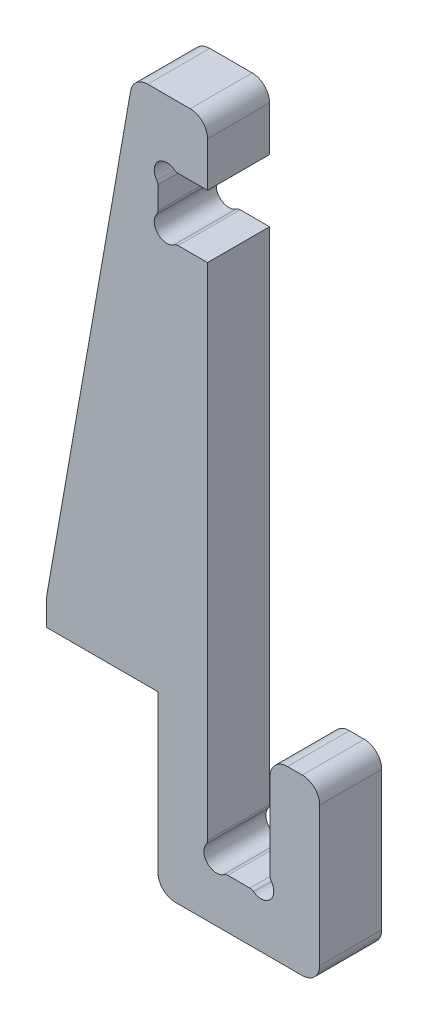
SolidWorks part; units mm, degrees
ref_plane "Plan de face" through (0, 0, 0) normal (0, 0, 1) x (1, 0, 0)
ref_plane "Plan de dessus" through (0, 0, 0) normal (0, 1, 0) x (1, 0, 0)
ref_plane "Plan de droite" through (0, 0, 0) normal (1, 0, 0) x (0, 0, -1)
sketch "Esquisse2" plane through (0, 0, 0) normal (0, 0, 1) x (1, 0, 0)
  line L0 (32.6, 32.6) -> (32.6, 20) construction
  line L2 (45.2, 70) -> (45.2, 28.131)
  line L3 (12.6, 242.4) -> (0, 242.4) construction
  line L4 (20, 229.8) -> (8.131, 229.8)
  line L5 (20, 229.8) -> (20, 28.131)
  line L6 (28.131, 20) -> (37.069, 20)
  line L7 (20, 20) -> (32.6, 32.6) construction
  line L8 (45.2, 70) -> (65.2, 70)
  line L9 (65.2, 70) -> (65.2, 0)
  line L10 (20, 255) -> (8.131, 255)
  line L11 (0, 246.869) -> (0, 237.931)
  line L12 (0, 255) -> (12.6, 242.4) construction
  line L13 (65.2, 0) -> (0, 0)
  line L14 (0, 0) -> (0, 70)
  line L15 (0, 70) -> (-45, 70)
  line L16 (-45, 70) -> (-45, 80)
  line L17 (-45, 80) -> (-10, 280)
  line L18 (-10, 280) -> (20, 280)
  line L19 (20, 280) -> (20, 255)
  arc A0 (19.5086, 26.6426) -> (26.6426, 19.5086) centre (23.6062, 23.6062) ccw
  arc A1 (19.5086, 26.6426) -> (20, 28.131) centre (17.5, 28.131) ccw
  arc A2 (26.6426, 19.5086) -> (28.131, 20) centre (28.131, 17.5) cw
  arc A3 (38.5574, 19.5086) -> (37.069, 20) centre (37.069, 17.5) ccw
  arc A4 (45.6914, 26.6426) -> (38.5574, 19.5086) centre (41.5938, 23.6062) cw
  arc A5 (45.6914, 26.6426) -> (45.2, 28.131) centre (47.7, 28.131) cw
  arc A6 (6.6426, 255.4914) -> (-0.4914, 248.3574) centre (3.6062, 251.3938) ccw
  arc A7 (6.6426, 255.4914) -> (8.131, 255) centre (8.131, 257.5) ccw
  arc A8 (-0.4914, 248.3574) -> (0, 246.869) centre (-2.5, 246.869) cw
  arc A9 (-0.4914, 236.4426) -> (0, 237.931) centre (-2.5, 237.931) ccw
  arc A10 (6.6426, 229.3086) -> (-0.4914, 236.4426) centre (3.6062, 233.4062) cw
  arc A11 (6.6426, 229.3086) -> (8.131, 229.8) centre (8.131, 227.3) cw
  point P17 (32.6, 20)
  point P37 (0, 242.4)
  point P41 (32.6, 0)
extrude "Boss.-Extru.2" add sketch "Esquisse2" along normal blind 25
fillet "Congé1" radius 7 6 edges at (45.2, 70, 12.5) (65.2, 70, 12.5) (65.2, 0, 12.5) (0, 0, 12.5) (20, 280, 12.5) (-10, 280, 12.5)
equation "\"D1@Boss.-Extru.2\" = \"material_thickness\""
equation "\"tool_diameter\"=10"
equation "\"hole_clearance\"=0.1"
equation "\"material_thickness\"=25"
equation "\"clearance\"=0.1"
equation "\"outer_slot\"=0.5"
equation "\"fillet\"=7"
equation "\"string\"= 2 * \"tool_diameter\" / 2 * cos ( 45deg )"
equation "\"angle\"= IIF ( \"string\" < \"limit\" , 45 , ( 180 - 2 * arcsin ( \"ThicknessVStool_dia\" ) ) / 2 )"
equation "\"limit\"= \"material_thickness\" / 2 * 5 / 6"
equation "\"ThicknessVStool_dia\"= IIF ( \"limit\" / \"tool_diameter\" > 1 , 1 , \"limit\" / \"tool_diameter\" )"
equation "\"D1@Congé1\"=\"fillet\""
equation "\"D4@Esquisse2\"=\"tool_diameter\" / 2 + \"hole_clearance\""
equation "\"D3@Esquisse2\" = \"material_thickness\" / 2 + \"clearance\""
equation "\"D5@Esquisse2\"=\"material_thickness\"/10"
equation "\"D1@Esquisse2\"= \"angle\""
equation "\"D8@Esquisse2\"=\"tool_diameter\" / 2 + \"hole_clearance\""
equation "\"D7@Esquisse2\" = \"material_thickness\" / 2 + \"clearance\""
equation "\"D9@Esquisse2\"=\"material_thickness\"/10"
equation "\"D2@Esquisse2\"=\"angle\""
equation "\"D12@Esquisse2\"=\"material_thickness\"*2"
